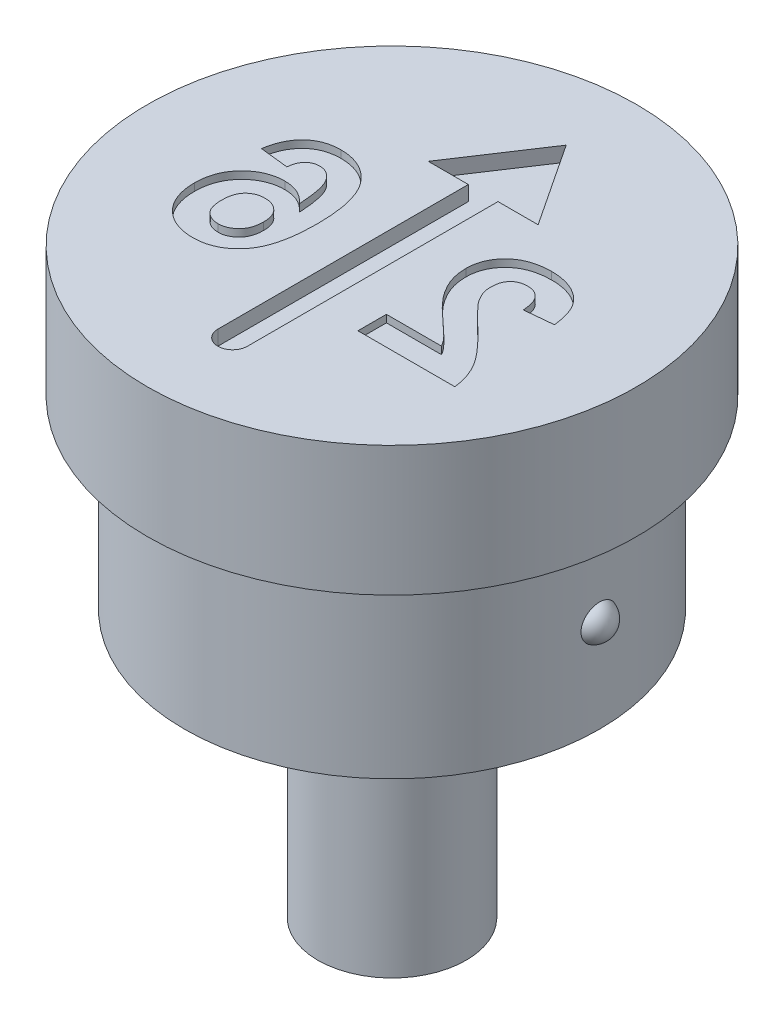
SolidWorks part; units mm, degrees
ref_plane "Front Plane" through (0, 0, 0) normal (0, 0, 1) x (1, 0, 0)
ref_plane "Top Plane" through (0, 0, 0) normal (0, 1, 0) x (1, 0, 0)
ref_plane "Right Plane" through (0, 0, 0) normal (1, 0, 0) x (0, 0, -1)
sketch "Sketch1" plane through (0, 0, 0) normal (0, 0, 1) x (1, 0, 0)
  line L0 (0, 0) -> (0, -15.7) construction
  line L1 (0, -7.26) -> (0, 7.26) construction
  line L2 (0, 0) -> (-6.6, 0)
  line L3 (-6.6, 0) -> (-6.6, -3.5)
  line L4 (-6.6, -3.5) -> (-5.6, -3.5)
  line L5 (-5.6, -3.5) -> (-5.6, -8.5)
  line L6 (-5.6, -8.5) -> (-2, -8.5)
  line L7 (-2, -8.5) -> (-2, -15.7)
  line L8 (-2, -15.7) -> (0, -15.7)
  line L9 (0, -15.7) -> (0, 0)
  dimension "D1" = 13.2
  dimension "D2" = 15.7
  dimension "D3" = 3.5
  dimension "D4" = 8.5
  dimension "D5" = 11.2
  dimension "D6" = 4
revolve "Revolve1" add sketch "Sketch1" angle 360 about L0
sketch "Sketch3" plane through (0, 0, 0) normal (0, 1, 0) x (1, 0, 0)
  line L0 (0, 4.7) -> (-1.4826, 2.46)
  line L1 (-1.4826, 2.46) -> (-0.4, 2.46)
  line L2 (-0.4, 2.46) -> (-0.4, -4.3)
  line L3 (0.4, -4.3) -> (0.4, 2.46)
  line L4 (0.4, 2.46) -> (1.4826, 2.46)
  line L5 (1.4826, 2.46) -> (0, 4.7)
  line L6 (0, 4.7) -> (0, -4.7) construction
  arc A0 (-0.4, -4.3) -> (0.4, -4.3) centre (0, -4.3) ccw
  dimension "D3" = 0.4
  dimension "D1" = 2.24
  dimension "D2" = 67
  dimension "D4" = 9
extrude "Cut-Extrude1" cut sketch "Sketch3" against normal blind 0.4
sketch "Sketch4" plane through (0, 0, 0) normal (0, 1, 0) x (1, 0, 0)
  text T0 "26" font "Arial" height 4
extrude "Cut-Extrude2" cut sketch "Sketch4" against normal blind 0.2
sketch "Sketch5" plane through (0, 0, 0) normal (0, 0, 1) x (1, 0, 0)
  line L2 (5.4373, -5.5) -> (5.4373, -6.5)
  line L3 (5.4373, -5.5) -> (5.4373, -6.5) construction
  line L4 (-5.6, -6) -> (5.4373, -6) construction
  line L5 (-5.6, -3.5) -> (-5.6, -8.5) construction
  arc A1 (5.4373, -6.5) -> (5.4373, -5.5) centre (5.4373, -6) ccw
  dimension "D1" = 0.5
revolve "Revolve2" add sketch "Sketch5" angle 360 about L2
